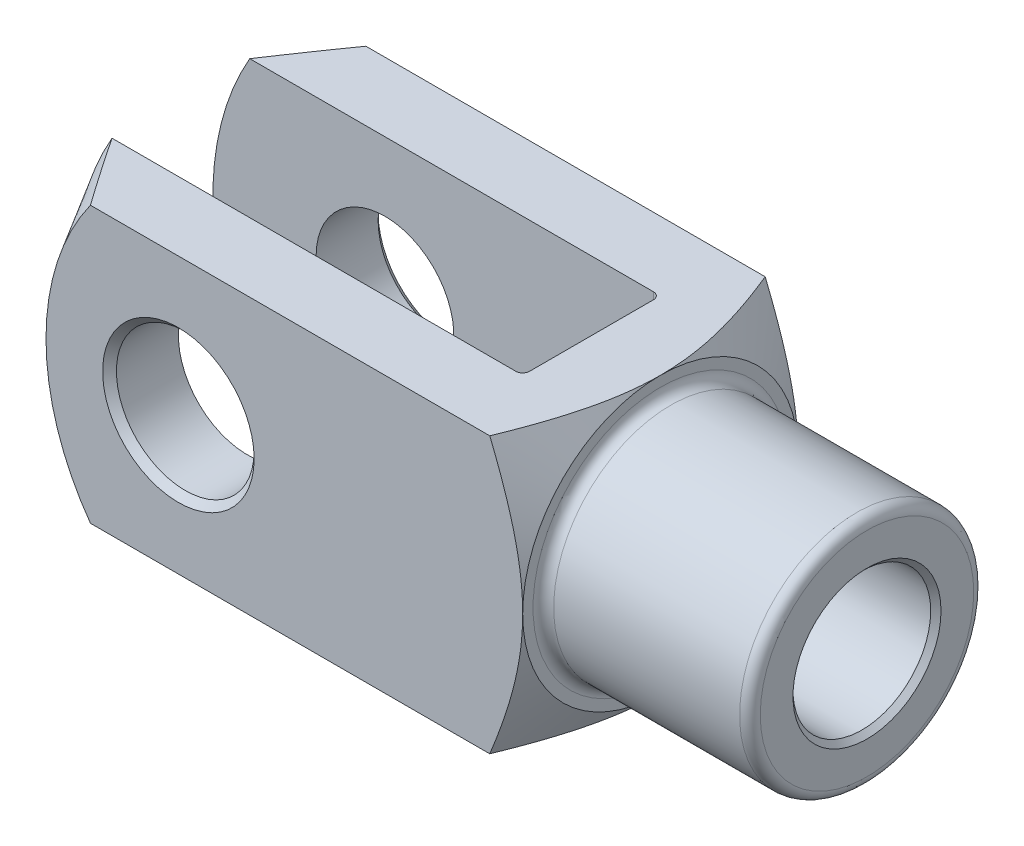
SolidWorks part; units mm, degrees
ref_plane "Front Plane" through (0, 0, 0) normal (0, 0, 1) x (1, 0, 0)
ref_plane "Top Plane" through (0, 0, 0) normal (0, 1, 0) x (1, 0, 0)
ref_plane "Right Plane" through (0, 0, 0) normal (1, 0, 0) x (0, 0, -1)
sketch "Sketch1" plane through (0, 0, 0) normal (1, 0, 0) x (0, 0, -1)
  line L0 (0, 0) -> (0, 50000) construction
  line L1 (0, 0) -> (50000, 0) construction
  line L2 (-20, -20) -> (-20, 20)
  line L3 (-20, 20) -> (20, 20)
  line L4 (20, -20) -> (20, 20)
  line L5 (-20, -20) -> (20, -20)
  point P9 (0, 20)
  point P11 (20, 0)
  point P12 (-20, 0)
  dimension "D1" = 40
  dimension "D2" = 40
extrude "Extrude1" add sketch "Sketch1" against normal blind 105
sketch "Sketch2" plane through (0, 0, 0) normal (1, 0, 0) x (0, 0, -1)
  circle A0 centre (0, 0) radius 17
  circle A1 centre (0, 0) radius 34
  dimension "D1" = 34
  dimension "D2" = 68
extrude "Extrude2" cut sketch "Sketch2" against normal blind 30
sketch "Sketch3" plane through (0, 0, 20) normal (0, 0, 1) x (1, 0, 0)
  circle A0 centre (-80, 0) radius 10
  dimension "D1" = 20
  dimension "D2" = 80
extrude "Extrude3" cut sketch "Sketch3" against normal through all
sketch "Sketch4" plane through (0, 20, 0) normal (0, 1, 0) x (1, 0, 0)
  line L0 (0, 0) -> (-50000, 0) construction
  line L1 (-105, -10) -> (-105, 10)
  line L2 (-105, 20) -> (-105, -20) construction
  line L3 (-105, 10) -> (-40, 10)
  line L4 (-40, 10) -> (-40, -10)
  line L5 (-80, 20) -> (-80, -20) construction
  line L6 (-105, -10) -> (-40, -10)
  point P7 (-80, 0)
  point P13 (-40, 0)
  point P14 (-105, 0)
  dimension "D1" = 40
  dimension "D2" = 20
extrude "Extrude4" cut sketch "Sketch4" against normal through all
fillet "Fillet1" radius 1 2 edges at (-40, 0, 10) (-40, 0, -10)
fillet "Fillet2" radius 1.5 2 edges at (0, 0, -17) (-30, 0, -17)
chamfer "Chamfer2" distance 1 angle 45 2 edges at (-70, 0, -20) (-70, 0, 20)
sketch "Sketch6" plane through (0, 0, 0) normal (0, 0, 1) x (1, 0, 0)
  line L0 (-30, -20) -> (-30, -40)
  line L1 (-30, -40) -> (-41.547, -40)
  line L2 (-41.547, -40) -> (-30, -20)
  dimension "D1" = 30
  dimension "D2" = 40
revolve "Cut-Revolve1" cut sketch "Sketch6" angle 360 about axis through (-30, 0, 0) along (1, 0, 0)
sketch "Sketch7" plane through (0, 0, 0) normal (0, 1, 0) x (1, 0, 0)
  line L0 (-99.2265, -20) -> (-105, -10)
  line L1 (-105, 10) -> (-99.2265, 20)
  line L2 (-99.2265, 20) -> (-145, 20)
  line L3 (-105, 10) -> (-105, -10)
  line L4 (-145, 20) -> (-145, -20)
  line L5 (-145, -20) -> (-99.2265, -20)
  line L6 (-105, 20) -> (-34.7829, 20) construction
  line L7 (-105, -20) -> (-34.7829, -20) construction
  line L8 (-65, 0.6162) -> (-65, 50000.6162) construction
  dimension "D1" = 120
  dimension "D2" = 40
  dimension "D3" = 40
revolve "Cut-Revolve2" cut sketch "Sketch7" angle 180 about L8
sketch "Sketch8" plane through (0, 0, 0) normal (1, 0, 0) x (0, 0, -1)
  circle A0 centre (0, 0) radius 10
  dimension "D1" = 20
extrude "Extrude5" cut sketch "Sketch8" against normal through all
chamfer "Chamfer3" distance 0.75 angle 45 1 edges at (0, 0, -10)
equation "\"D2@Sketch1\" = \"D1@Sketch1\""
equation "\"D2@Sketch2\" = \"D1@Sketch2\"*2"
equation "\"D2@Sketch6\" = \"D1@Sketch1\""
equation "\"D2@Sketch7\" = \"D1@Sketch1\""
equation "\"D3@Sketch7\" = \"D1@Sketch1\""
